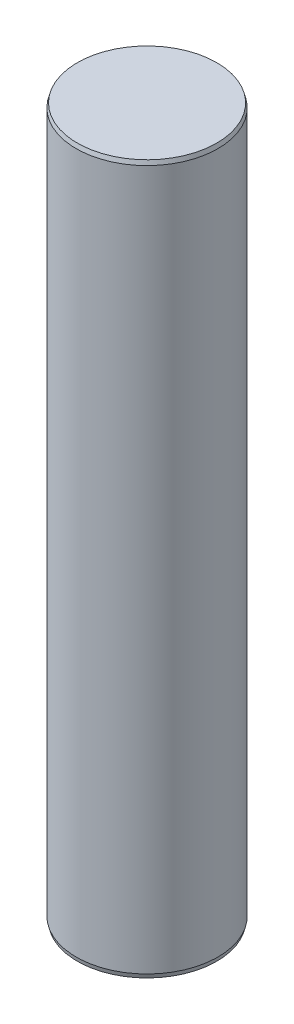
SolidWorks part; units mm, degrees
ref_plane "Face" through (0, 0, 0) normal (0, 0, 1) x (1, 0, 0)
ref_plane "Dessus" through (0, 0, 0) normal (0, 1, 0) x (1, 0, 0)
ref_plane "Droite" through (0, 0, 0) normal (1, 0, 0) x (0, 0, -1)
sketch "Esquisse1" plane through (0, 0, 0) normal (0, 0, 1) x (1, 0, 0)
  line L1 (2, -19.88) -> (2, -0.12)
  line L2 (0, 0) -> (0, -20.7306) construction
  line L3 (2, -19.88) -> (1.9678, -20)
  line L4 (0, 0) -> (0, -20)
  line L5 (0, -20) -> (1.9678, -20)
  line L6 (-2, 0) -> (2, 0) construction
  line L7 (0, 0) -> (1.9678, 0)
  line L8 (2, -0.12) -> (1.9678, 0)
  line L9 (0, 0) -> (0, 5.0587) construction
  dimension "D1" = 15
  dimension "D2" = 15
  dimension "Longueur" = 20
  dimension "Hauteur chamfrein" = 0.12
  dimension "Rn" = 2
  dimension "Diamètre nominal" = 4
revolve "Base-Révolution" add sketch "Esquisse1" angle 360 about L9
equation "\"Rn@Esquisse1\" = \"Diamètre nominal@Esquisse1\"/2"
